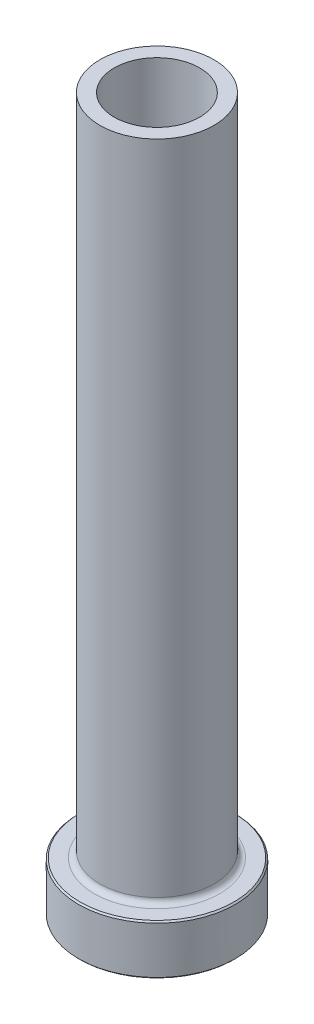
SolidWorks part; units mm, degrees
ref_plane "Front Plane" through (0, 0, 0) normal (0, 0, 1) x (1, 0, 0)
ref_plane "Top Plane" through (0, 0, 0) normal (0, 1, 0) x (1, 0, 0)
ref_plane "Right Plane" through (0, 0, 0) normal (1, 0, 0) x (0, 0, -1)
sketch "Sketch1" plane through (0, 0, 0) normal (0, 0, 1) x (1, 0, 0)
  line L0 (-6, 100) -> (-8, 100)
  line L1 (-8, 100) -> (-8, 7)
  line L2 (-8, 7) -> (-11, 7)
  line L3 (-11, 7) -> (-11, 0)
  line L4 (12.1, 0) -> (-12.1, 0) construction
  line L5 (-11, 0) -> (-6.25, 0)
  line L6 (-6, 45) -> (-6, 100)
  line L7 (0, 92.1877) -> (0, -15.5353) construction
  line L8 (0, -12.1) -> (0, 12.1) construction
  line L9 (-6, 45) -> (-6.25, 33)
  line L10 (-6.25, 33) -> (-6.25, 0)
  dimension "D1" = 0.25
  dimension "ID" = 12
  dimension "OD" = 16
  dimension "L" = 100
  dimension "H" = 22
  dimension "T" = 7
  dimension "N" = 55
  dimension "D2" = 12
revolve "Revolve1" add sketch "Sketch1" angle 360 about L7
fillet "Fillet1" radius 0.8 1 edges at (0, 7, 8)
chamfer "Chamfer1" distance 0.2 angle 45 2 edges at (0, 7, 11) (0, 0, 11)
chamfer "Chamfer3" distance 0.5 angle 45 1 edges at (0, 0, 6.25)
